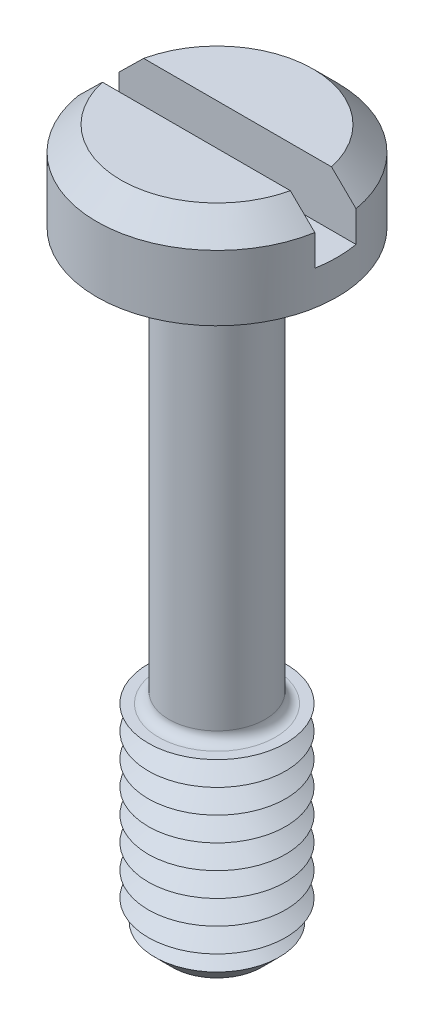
SolidWorks part; units mm, degrees
ref_plane "Front Plane" through (0, 0, 0) normal (0, 0, 1) x (1, 0, 0)
ref_plane "Top Plane" through (0, 0, 0) normal (0, 1, 0) x (1, 0, 0)
ref_plane "Right Plane" through (0, 0, 0) normal (1, 0, 0) x (0, 0, -1)
sketch "Sketch1" plane through (0, 0, 0) normal (0, 1, 0) x (1, 0, 0)
  circle A0 centre (0, 0) radius 3.5
  dimension "D1" = 7
extrude "Boss-Extrude1" add sketch "Sketch1" along normal blind 2.6
sketch "Sketch2" plane through (0, 0, 0) normal (0, -1, 0) x (1, 0, 0)
  circle A0 centre (0, 0) radius 1.4
  dimension "D1" = 2.8
extrude "Boss-Extrude2" add sketch "Sketch2" along normal blind 18
sketch "Sketch3" plane through (0, -18, 0) normal (0, -1, 0) x (1, 0, 0)
  circle A0 centre (0, 0) radius 2
  dimension "D1" = 4
extrude "Boss-Extrude3" add sketch "Sketch3" against normal blind 6
chamfer "Chamfer1" distance 0.7 angle 45 1 edges at (0, -18, -2)
sketch "Sketch4" plane through (0, 0, 0) normal (1, 0, 0) x (0, 0, -1)
  line L0 (0, -6.5871) -> (0, -12.0372) construction
sketch "Sketch5" plane through (0, 0, 0) normal (1, 0, 0) x (0, 0, -1)
  line L0 (-2, -12) -> (-1.3938, -12.35)
  line L1 (-1.3938, -12.35) -> (-2, -12.7)
  line L2 (-2, -12) -> (-2, -17.3) construction
  line L3 (-2, -12.7) -> (-2, -12)
  dimension "D1" = 0.7
revolve "Cut-Revolve1" cut sketch "Sketch5" angle 360 about L0
pattern_linear "LPattern1" count 8 spacing 0.7 along (0, -1, 0) of "Cut-Revolve1"
fillet "Fillet1" radius 0.3 2 edges at (0, -12, -1.4) (0, 0, -1.4)
chamfer "Chamfer2" distance 0.7 angle 45 1 edges at (0, 2.6, 3.5)
sketch "Sketch6" plane through (0, 2.6, 0) normal (0, 1, 0) x (1, 0, 0)
  line L1 (3.5, -0.6) -> (-3.5, -0.6)
  line L2 (3.5, -0.6) -> (3.5, 0.6)
  line L3 (3.5, 0.6) -> (-3.5, 0.6)
  line L4 (-3.5, -0.6) -> (-3.5, 0.6)
  line L5 (3.5, -0.6) -> (-3.5, 0.6) construction
  line L6 (3.5, 0.6) -> (-3.5, -0.6) construction
  circle A0 centre (0, 0) radius 3.5 construction
  point P0 (0, 0)
  dimension "D1" = 1.2
extrude "Cut-Extrude1" cut sketch "Sketch6" against normal blind 1.6
